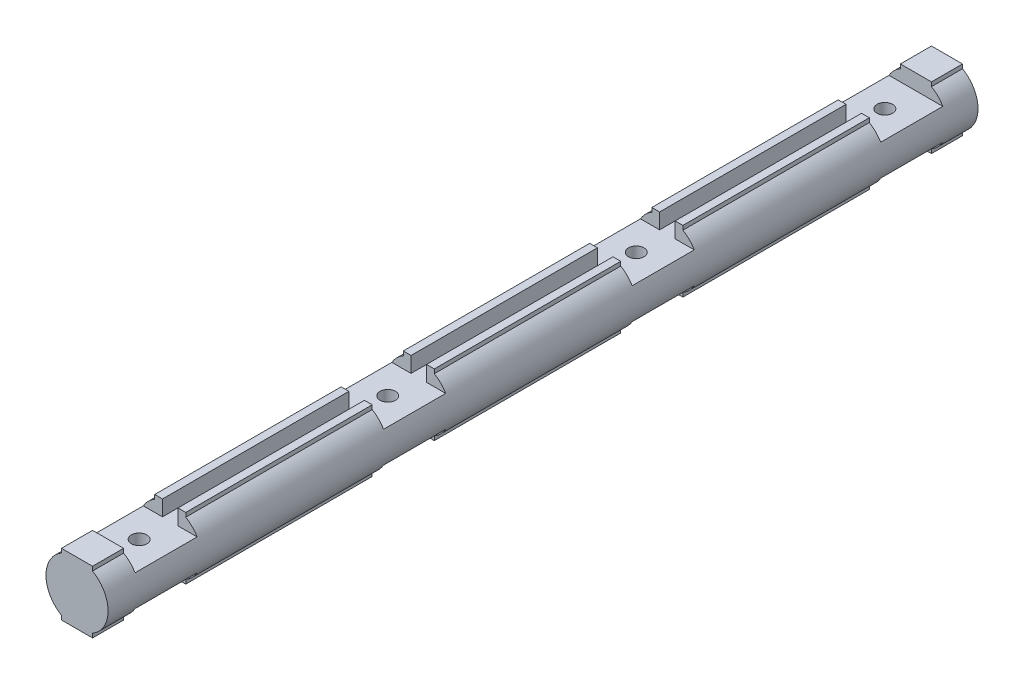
SolidWorks part; units mm, degrees
ref_plane "Front Plane" through (0, 0, 0) normal (0, 0, 1) x (1, 0, 0)
ref_plane "Top Plane" through (0, 0, 0) normal (0, 1, 0) x (1, 0, 0)
ref_plane "Right Plane" through (0, 0, 0) normal (1, 0, 0) x (0, 0, -1)
sketch "Sketch1" plane through (0, 0, 0) normal (0, 0, 1) x (1, 0, 0)
  circle A0 centre (0, 0) radius 10
  dimension "D1" = 20
extrude "Boss-Extrude1" add sketch "Sketch1" along normal mid plane 280
sketch "Sketch2" plane through (0, 0, 140) normal (0, 0, 1) x (1, 0, 0)
  line L1 (5, -10) -> (-5, -10)
  line L2 (5, -10) -> (5, 10)
  line L3 (5, 10) -> (-5, 10)
  line L4 (-5, -10) -> (-5, 10)
  line L5 (5, -10) -> (-5, 10) construction
  line L6 (5, 10) -> (-5, -10) construction
  circle A0 centre (0, 0) radius 10 construction
  point P0 (0, 0)
  dimension "D2" = 10
extrude "Boss-Extrude2" add sketch "Sketch2" against normal up to surface (280 mm away)
ref_plane "Plane1" through (0, 0, -120) normal (0, 0, -1) x (-1, 0, 0)
sketch "Sketch3" plane through (0, 0, -120) normal (0, 0, 1) x (1, 0, 0)
  line L1 (8.6603, 5) -> (-8.6603, 5)
  line L2 (8.6603, 5) -> (8.6603, 10)
  line L3 (8.6603, 10) -> (-8.6603, 10)
  line L4 (-8.6603, 5) -> (-8.6603, 10)
  line L5 (8.6603, 5) -> (-8.6603, 10) construction
  line L6 (8.6603, 10) -> (-8.6603, 5) construction
  circle A0 centre (0, 0) radius 10 construction
  point P0 (0, 7.5)
  dimension "D1" = 5
extrude "Cut-Extrude1" cut sketch "Sketch3" against normal mid plane 20
sketch "Sketch4" plane through (0, 5, 0) normal (0, 1, 0) x (1, 0, 0)
  line L0 (-8.6603, 130) -> (8.6603, 110) construction
  circle A0 centre (0, 120) radius 2.5
  dimension "D1" = 5
extrude "Cut-Extrude3" cut sketch "Sketch4" against normal through all
sketch "Sketch5" plane through (0, 10, 0) normal (0, 1, 0) x (1, 0, 0)
  line L0 (-8.6603, 110) -> (8.6603, 110) construction
  line L1 (2.5, -110) -> (-2.5, -110)
  line L2 (2.5, -110) -> (2.5, 110)
  line L3 (2.5, 110) -> (-2.5, 110)
  line L4 (-2.5, -110) -> (-2.5, 110)
  line L5 (2.5, -110) -> (-2.5, 110) construction
  line L6 (2.5, 110) -> (-2.5, -110) construction
  point P0 (0, 0)
  dimension "D1" = 5
extrude "Cut-Extrude2" cut sketch "Sketch5" against normal up to surface (5 mm away)
pattern_linear "LPattern1" count 4 spacing 80 along (0, 0, 1) of "Cut-Extrude1", "Cut-Extrude3"
mirror "Mirror3" about plane through (0, 0, 0) normal (0, 1, 0) of "Cut-Extrude1", "Cut-Extrude2", "LPattern1"
